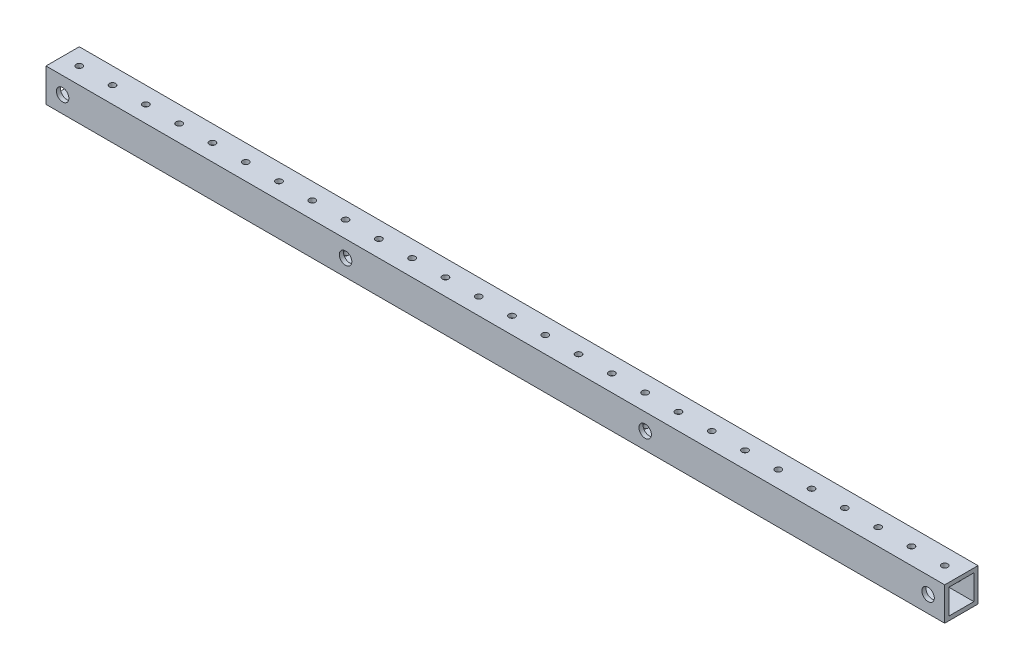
SolidWorks part; units mm, degrees
ref_plane "Front Plane" through (0, 0, 0) normal (0, 0, 1) x (1, 0, 0)
ref_plane "Top Plane" through (0, 0, 0) normal (0, 1, 0) x (1, 0, 0)
ref_plane "Right Plane" through (0, 0, 0) normal (1, 0, 0) x (0, 0, -1)
sketch "Sketch1" plane through (0, 0, 0) normal (1, 0, 0) x (0, 0, -1)
  line L1 (-12.7, -12.7) -> (12.7, -12.7)
  line L2 (-12.7, -12.7) -> (-12.7, 12.7)
  line L3 (-12.7, 12.7) -> (12.7, 12.7)
  line L4 (12.7, -12.7) -> (12.7, 12.7)
  line L5 (-12.7, -12.7) -> (12.7, 12.7) construction
  line L6 (-12.7, 12.7) -> (12.7, -12.7) construction
  line L7 (-9.525, -9.525) -> (9.525, -9.525)
  line L8 (-9.525, -9.525) -> (-9.525, 9.525)
  line L9 (-9.525, 9.525) -> (9.525, 9.525)
  line L10 (9.525, -9.525) -> (9.525, 9.525)
  line L11 (-9.525, -9.525) -> (9.525, 9.525) construction
  line L12 (-9.525, 9.525) -> (9.525, -9.525) construction
  point P0 (0, 0)
  point P6 (0, 0)
  dimension "D1" = 25.4
  dimension "D2" = 3.175
extrude "Boss-Extrude1" add sketch "Sketch1" along normal mid plane 685.8
sketch "Sketch2" plane through (0, 0, 12.7) normal (0, 0, -1) x (-1, 0, 0)
  line L0 (-398.4253, 0) -> (409.3758, 0) construction
  line L1 (-342.9, -12.7) -> (-342.9, 12.7) construction
  line L3 (0, 67.7028) -> (0, -69.8486) construction
  line L4 (342.9, -12.7) -> (342.9, 12.7) construction
  circle A0 centre (330.2, 0) radius 4.7625
  circle A1 centre (114.3, 0) radius 4.7625
  circle A2 centre (-114.3, 0) radius 4.7625
  circle A3 centre (-330.2, 0) radius 4.7625
  dimension "D2" = 9.525
  dimension "D3" = 12.7
  dimension "D4" = 114.3
  dimension "D5" = 114.3
  dimension "D6" = 12.7
extrude "Cut-Extrude1" cut sketch "Sketch2" along normal up to next
sketch "Sketch4" plane through (0, 12.7, 0) normal (0, 1, 0) x (1, 0, 0)
  line L0 (-396.0321, 0) -> (396.0321, 0) construction
  line L1 (-342.9, 12.7) -> (-342.9, -12.7) construction
  circle A0 centre (-330.2, 0) radius 2.3813
  dimension "D1" = 4.7625
  dimension "D2" = 12.7
extrude "Cut-Extrude3" cut sketch "Sketch4" against normal through all
pattern_linear "LPattern1" count 30 spacing 25.4 along (1, 0, 0) of "Cut-Extrude3"
sketch "Sketch5" plane through (0, 0, -9.525) normal (0, 0, 1) x (1, 0, 0)
  circle A0 centre (330.2, 0) radius 4.7625 construction
  circle A1 centre (330.2, 0) radius 4.7625 construction
  circle A2 centre (330.2, 0) radius 2.4892
  circle A3 centre (114.3, 0) radius 4.7625 construction
  circle A4 centre (114.3, 0) radius 4.7625 construction
  circle A5 centre (114.3, 0) radius 2.4892
  circle A6 centre (-114.3, 0) radius 4.7625 construction
  circle A7 centre (-114.3, 0) radius 4.7625 construction
  circle A8 centre (-114.3, 0) radius 2.4892
  circle A9 centre (-330.2, 0) radius 4.7625 construction
  circle A10 centre (-330.2, 0) radius 4.7625 construction
  circle A11 centre (-330.2, 0) radius 2.4892
  dimension "D1" = 4.9784
  dimension "D2" = 4.9784
  dimension "D3" = 4.9784
  dimension "D4" = 4.9784
extrude "Cut-Extrude4" cut sketch "Sketch5" against normal through all
